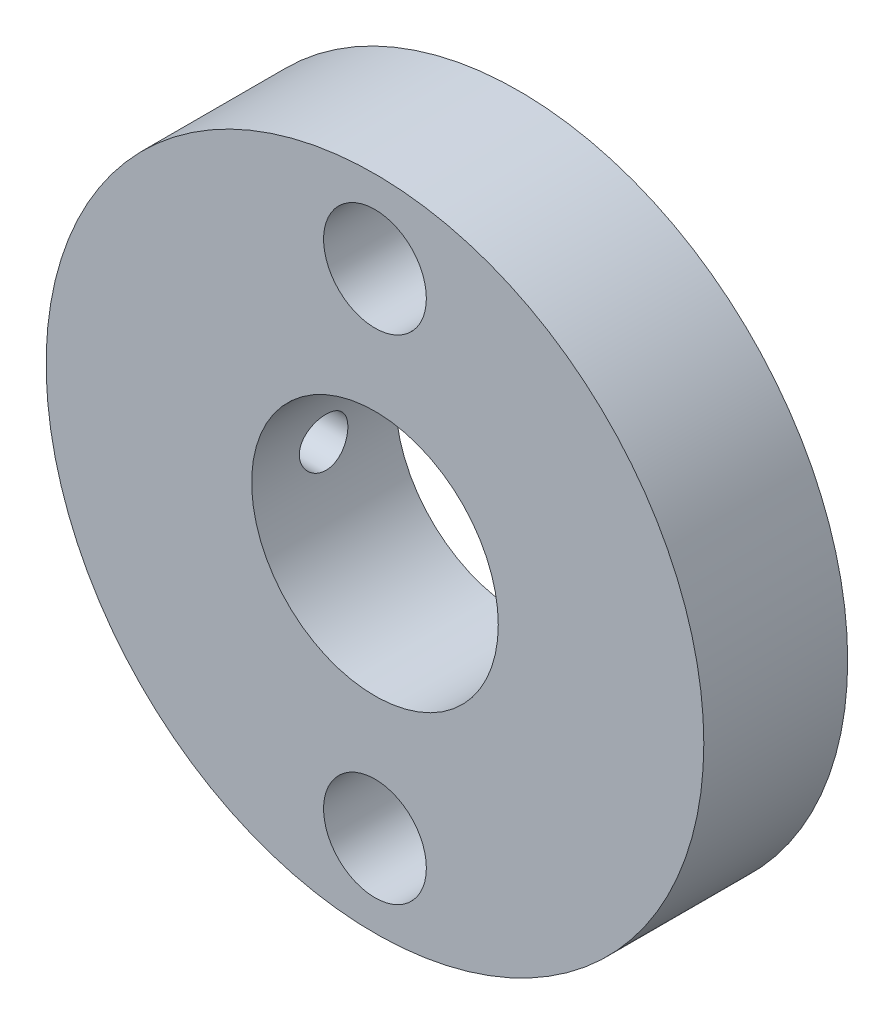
SolidWorks part; units mm, degrees
ref_plane "Front Plane" through (0, 0, 0) normal (0, 0, 1) x (1, 0, 0)
ref_plane "Top Plane" through (0, 0, 0) normal (0, 1, 0) x (1, 0, 0)
ref_plane "Right Plane" through (0, 0, 0) normal (1, 0, 0) x (0, 0, -1)
sketch "Sketch2" plane through (0, 0, 0) normal (0, 0, 1) x (1, 0, 0)
  line L0 (19.05, 82.6424) -> (19.05, 17.2196) construction
  line L1 (0, 82.6424) -> (38.1, 82.6424) construction
  line L2 (0, 82.6424) -> (0, 17.2196) construction
  line L3 (0, 17.2196) -> (38.1, 17.2196) construction
  line L4 (38.1, 82.6424) -> (38.1, 17.2196) construction
  line L5 (0, 49.931) -> (38.1, 49.931) construction
  circle A0 centre (19.05, 49.931) radius 50.8
  point P12 (19.05, 49.931)
  dimension "D1" = 101.6
extrude "Boss-Extrude1" add sketch "Sketch2" along normal blind 22.225
sketch "Sketch5" plane through (0, 0, 22.225) normal (0, 0, 1) x (1, 0, 0)
  line L0 (19.05, 100.731) -> (19.05, 60.9198) construction
  circle A0 centre (19.05, 88.031) radius 6.35 construction
  circle A1 centre (19.05, 88.031) radius 4.925
  circle A2 centre (19.05, 11.831) radius 6.35 construction
  circle A3 centre (19.05, 11.831) radius 4.925
  circle A5 centre (19.05, 49.931) radius 50.8 construction
  dimension "D1" = 76.2
  dimension "D3" = 9.85
  dimension "D4" = 9.85
  dimension "D2" = 12.7
extrude "Cut-Extrude2" cut sketch "Sketch5" against normal through all
sketch "Sketch13" plane through (0, 0, 22.225) normal (0, 0, 1) x (1, 0, 0)
  line L0 (19.05, 123.2866) -> (19.05, 83.4754) construction
  circle A0 centre (19.05, 88.031) radius 7.9375
  circle A1 centre (19.05, 88.031) radius 4.7625 construction
  circle A2 centre (19.05, 11.831) radius 7.9375
  circle A3 centre (19.05, 11.831) radius 4.7625 construction
  circle A4 centre (19.05, 11.831) radius 4.925 construction
  circle A5 centre (19.05, 88.031) radius 4.925 construction
  dimension "D1" = 15.875
extrude "Cut-Extrude8" cut sketch "Sketch13" against normal blind 15.875
sketch "Sketch17" plane through (0, 0, 22.225) normal (0, 0, 1) x (1, 0, 0)
  circle A0 centre (19.05, 49.931) radius 19.05
  dimension "D2" = 38.1
extrude "Cut-Extrude10" cut sketch "Sketch17" against normal blind 48.006
sketch "Sketch19" plane through (0, 0, 0) normal (1, 0, 0) x (0, 0, -1)
  line L0 (-22.225, -0.869) -> (0, -0.869) construction
  line L1 (0, -0.869) -> (0, 100.731) construction
  circle A0 centre (-11.1125, 49.931) radius 3.75
  dimension "D3" = 7.5
  dimension "D1" = 50.8
  dimension "D2" = 11.1125
extrude "Cut-Extrude11" cut sketch "Sketch19" against normal blind 55.626 and the other way blind 14.986
